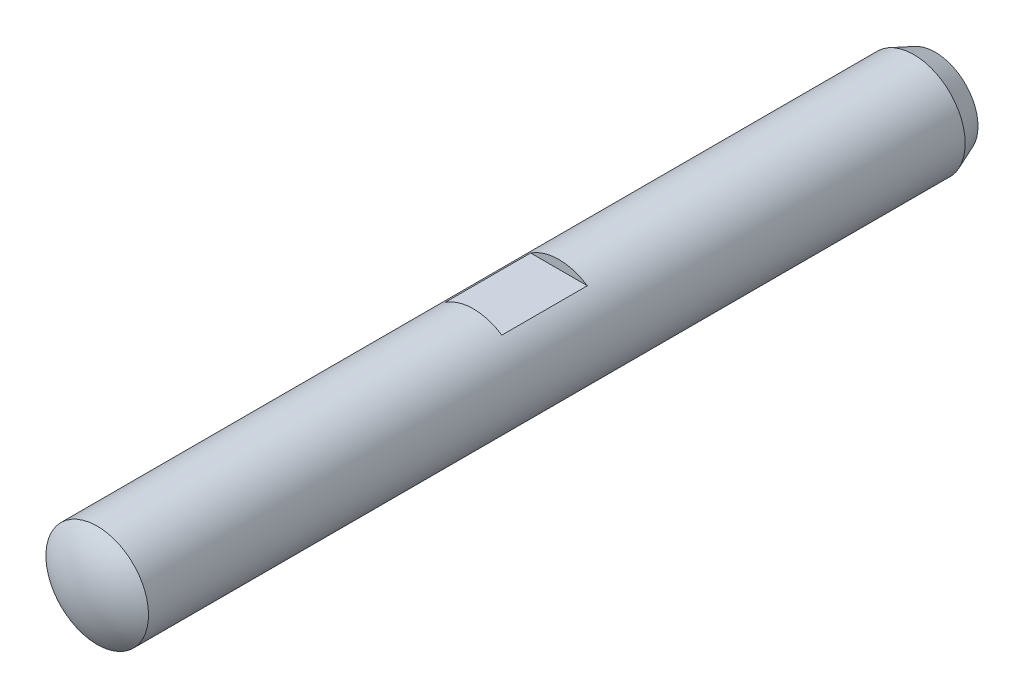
SolidWorks part; units mm, degrees
ref_plane "Plan1" through (0, 0, 0) normal (0, 0, 1) x (1, 0, 0)
ref_plane "Plan2" through (0, 0, 0) normal (0, 1, 0) x (1, 0, 0)
ref_plane "Plan3" through (0, 0, 0) normal (1, 0, 0) x (0, 0, -1)
sketch "base" plane through (0, 0, 0) normal (0, 0, 1) x (1, 0, 0)
  circle A0 centre (0, 0) radius 3
  dimension "D1" = 6
extrude "Base-Extrusion" add sketch "base" along normal blind 49
dome "Dôme3" faces to dome 1 distance 1 parameters "D1"=1
chamfer "Chanfrein1" distance 0.5 distance2 1.25
dome "Dôme2" faces to dome 1 distance 0.75 parameters "D1"=0.75
ref_plane "Plan4" through (0, 0, 22) normal (0, 0, 1) x (1, 0, 0)
sketch "Esquisse1" plane through (0, 0, 22) normal (0, 0, 1) x (1, 0, 0)
  line L1 (-3.5, 2.5) -> (3.5, 2.5)
  line L2 (-3.5, 2.5) -> (-3.5, 4.5)
  line L3 (-3.5, 4.5) -> (3.5, 4.5)
  line L4 (3.5, 2.5) -> (3.5, 4.5)
  dimension "D1" = 2.5
  dimension "D2" = 2
  dimension "D3" = 7
  dimension "D4" = 3.5
extrude "Enlèv. mat.-Extru.1" cut sketch "Esquisse1" along normal blind 5
